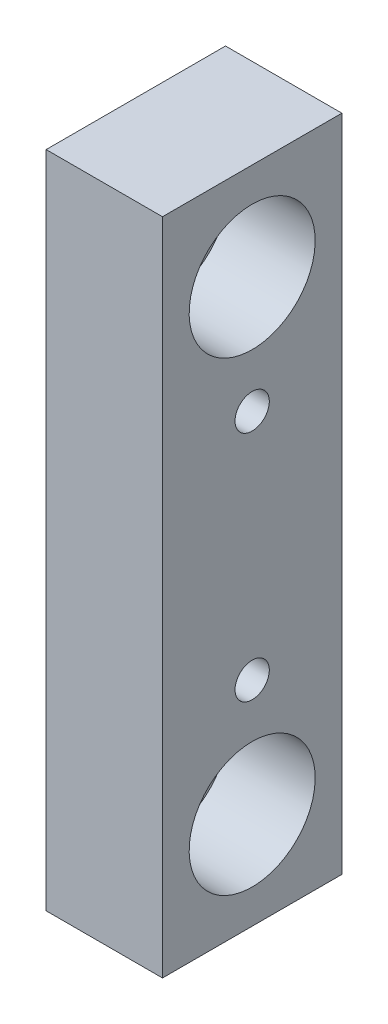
SolidWorks part; units mm, degrees
ref_plane "Front" through (0, 0, 0) normal (0, 0, 1) x (1, 0, 0)
ref_plane "Top" through (0, 0, 0) normal (0, 1, 0) x (1, 0, 0)
ref_plane "Right" through (0, 0, 0) normal (1, 0, 0) x (0, 0, -1)
sketch "Sketch1" plane through (0, 0, 0) normal (0, 0, 1) x (1, 0, 0)
  line L0 (82.55, 0) -> (0, 0) construction
  line L1 (-82.55, 101.6) -> (82.55, 101.6) construction
  line L2 (-82.55, 101.6) -> (-82.55, -101.6) construction
  line L3 (-82.55, -101.6) -> (82.55, -101.6) construction
  line L4 (82.55, 101.6) -> (82.55, -101.6) construction
  line L5 (0, 0) -> (0, 101.6) construction
  line L6 (52.3634, 101.6) -> (-52.3634, 101.6)
  line L8 (-52.3634, -101.6) -> (52.3634, -101.6)
  circle A0 centre (0, 0) radius 76.327 construction
  arc A1 (-52.3634, 101.6) -> (-52.3634, -101.6) centre (0, 0) ccw
  arc A2 (52.3634, -101.6) -> (52.3634, 101.6) centre (0, 0) ccw
  dimension "D3" = 152.654
  dimension "D4" = 228.6
  dimension "D1" = 203.2
  dimension "D2" = 165.1
extrude "Boss-Extrude1" add sketch "Sketch1" along normal mid plane 31.75
sketch "Sketch3" plane through (0, 0, 15.875) normal (0, 0, 1) x (1, 0, 0)
  circle A0 centre (0, 0) radius 74.2188
  circle A1 centre (0, 0) radius 76.327 construction
  dimension "D1" = 2.1082
extrude "Cut-Extrude2" cut sketch "Sketch3" against normal through all
sketch "Sketch4" plane through (0, 0, 0) normal (0, 1, 0) x (1, 0, 0)
  line L0 (52.3634, -15.875) -> (114.3, -15.875) construction
  line L1 (76.2508, -28.575) -> (76.2508, -25.0038)
  line L2 (76.2508, -25.0038) -> (74.2188, -25.0038)
  line L3 (0, 0) -> (30.5583, 0) construction
  line L4 (50.8, 15.875) -> (50.8, 19.3424)
  line L5 (50.8, 19.3424) -> (60.325, 22.8092)
  line L6 (0, 0) -> (0, 54.6666) construction
  line L7 (60.325, 22.8092) -> (60.325, 28.575)
  line L8 (60.325, 28.575) -> (47.6758, 28.575)
  line L9 (45.6438, 25.0038) -> (45.6438, 15.875)
  line L10 (45.6438, 15.875) -> (50.8, 15.875)
  line L11 (47.6758, 25.0038) -> (45.6438, 25.0038)
  line L12 (47.6758, 28.575) -> (47.6758, 25.0038)
  line L13 (114.3, 15.875) -> (52.3634, 15.875) construction
  line L20 (74.2188, -15.875) -> (79.375, -15.875)
  line L21 (74.2188, -25.0038) -> (74.2188, -15.875)
  line L22 (88.9, -28.575) -> (76.2508, -28.575)
  line L23 (88.9, -22.8092) -> (88.9, -28.575)
  line L24 (79.375, -19.3424) -> (88.9, -22.8092)
  line L25 (79.375, -15.875) -> (79.375, -19.3424)
  dimension "D1" = 5.1562
  dimension "D2" = 5.7658
  dimension "D3" = 177.8
  dimension "D4" = 9.2326
  dimension "D5" = 12.7
  dimension "D6" = 14.6812
  dimension "D7" = 20
  dimension "D8" = 2.032
  dimension "D9" = 3.5712
  dimension "D10" = 5.1562
  dimension "D11" = 12.7
  dimension "D12" = 5.7658
  dimension "D13" = 3.5712
  dimension "D14" = 20
  dimension "D15" = 9.2326
  dimension "D16" = 2.032
  dimension "D17" = 14.6812
  dimension "D18" = 120.65
revolve "Revolve1" add sketch "Sketch4" angle 360 mid plane about L6
sketch "Sketch5" plane through (0, 0, -15.875) normal (0, 0, 1) x (1, 0, 0)
  circle A0 centre (0, 0) radius 45.6438 construction
  circle A1 centre (0, 0) radius 45.6438
  circle A2 centre (0, 0) radius 74.2188 construction
  circle A3 centre (0, 0) radius 74.2188
extrude "Boss-Extrude2" add sketch "Sketch5" along normal up to surface (40.8788 mm away)
sketch "Sketch6" plane through (0, 0, 0) normal (0, 1, 0) x (1, 0, 0)
  line L0 (32.1437, -0.635) -> (32.1437, 0.635) construction
  line L1 (-25.7937, -6.985) -> (25.7937, -6.985) construction
  line L2 (25.7937, 6.985) -> (-25.7937, 6.985) construction
  line L3 (-32.1437, 0.635) -> (-32.1437, -0.635) construction
  line L4 (32.1437, -0.635) -> (32.1437, 0.635)
  line L5 (-25.7937, -6.985) -> (25.7937, -6.985)
  line L6 (25.7937, 6.985) -> (-25.7937, 6.985)
  line L7 (-32.1437, 0.635) -> (-32.1437, -0.635)
  arc A0 (25.7937, -6.985) -> (32.1437, -0.635) centre (25.7937, -0.635) ccw construction
  arc A1 (32.1437, 0.635) -> (25.7937, 6.985) centre (25.7937, 0.635) ccw construction
  arc A2 (-25.7937, 6.985) -> (-32.1437, 0.635) centre (-25.7937, 0.635) ccw construction
  arc A3 (-32.1437, -0.635) -> (-25.7937, -6.985) centre (-25.7937, -0.635) ccw construction
  arc A4 (25.7937, -6.985) -> (32.1437, -0.635) centre (25.7937, -0.635) ccw
  arc A5 (32.1437, 0.635) -> (25.7937, 6.985) centre (25.7937, 0.635) ccw
  arc A6 (-25.7937, 6.985) -> (-32.1437, 0.635) centre (-25.7937, 0.635) ccw
  arc A7 (-32.1437, -0.635) -> (-25.7937, -6.985) centre (-25.7937, -0.635) ccw
extrude "Cut-Extrude3" cut sketch "Sketch6" against normal mid plane 228.6
hole_wizard "#10-32 Tapped Hole1" positions "Sketch8" profile "Sketch7" tap size "#10-32" standard "Ansi Inch"
sketch "Sketch8" plane through (0, 101.6, 0) normal (0, 1, 0) x (-1, 0, 0)
  point P0 (-41.275, 7.9375)
  point P1 (-41.275, -7.9375)
  point P4 (41.275, -7.9375)
  point P7 (41.275, 7.9375)
sketch "Sketch7" plane through (41.275, 101.6, 7.9375) normal (1, 0, 0) x (0, 0, 1)
  line L0 (0, 0) -> (0, 17.9773)
  line L1 (0, 17.9773) -> (2.0193, 16.764)
  line L2 (2.0193, 16.764) -> (2.0193, 0)
  line L5 (2.0193, 0) -> (0, 0)
  line L10 (0, 17.9773) -> (-2.0193, 16.764) construction
  line L11 (0, -6.35) -> (0, 107.95) construction
  dimension "Tap Drill Dia." = 4.0386
  dimension "Tap Drill Depth" = 16.764
  dimension "Drill Angle" = 118
hole_wizard "#10-32 Tapped Hole2" positions "Sketch10" profile "Sketch9" tap size "#10-32" standard "Ansi Inch"
sketch "Sketch10" plane through (0, -101.6, 0) normal (0, -1, 0) x (1, 0, 0)
  point P0 (41.275, -7.9375)
  point P1 (-41.275, 7.9375)
  point P4 (-41.275, -7.9375)
  point P7 (41.275, 7.9375)
sketch "Sketch9" plane through (41.275, -101.6, -7.9375) normal (1, 0, 0) x (0, 0, -1)
  line L0 (0, 0) -> (0, 17.9773)
  line L1 (0, 17.9773) -> (2.0193, 16.764)
  line L2 (2.0193, 16.764) -> (2.0193, 0)
  line L5 (2.0193, 0) -> (0, 0)
  line L10 (0, 17.9773) -> (-2.0193, 16.764) construction
  line L11 (0, -6.35) -> (0, 107.95) construction
  dimension "Tap Drill Dia." = 4.0386
  dimension "Tap Drill Depth" = 16.764
  dimension "Drill Angle" = 118
sketch "Sketch15" plane through (0, 0, 15.875) normal (0, 0, 1) x (1, 0, 0)
  line L0 (50.8, 101.6) -> (50.8, 81.3352)
  line L1 (0, 0) -> (28.4177, 0) construction
  line L2 (0, 0) -> (0, 27.3386) construction
  line L3 (50.8, -101.6) -> (-50.8, -101.6)
  line L4 (-50.8, -101.6) -> (-50.8, -81.3352)
  line L5 (-50.8, 101.6) -> (-50.8, 81.3352)
  line L6 (52.3634, 101.6) -> (-52.3634, 101.6) construction
  line L7 (-52.3634, -101.6) -> (52.3634, -101.6) construction
  line L8 (50.8, 101.6) -> (-50.8, 101.6)
  line L9 (50.8, -101.6) -> (50.8, -81.3352)
  line L11 (-101.6, 50.8) -> (-101.6, -50.8)
  line L12 (-101.6, -50.8) -> (-81.3352, -50.8)
  line L13 (-101.6, 50.8) -> (-81.3352, 50.8)
  arc A0 (-55.6846, 71.3247) -> (-71.3247, 55.6846) centre (0, 0) ccw
  arc A1 (55.6846, -71.3247) -> (55.6846, 71.3247) centre (0, 0) ccw
  arc A2 (-50.8, -81.3352) -> (-55.6846, -71.3247) centre (-63.5, -81.3352) ccw
  arc A3 (50.8, -81.3352) -> (55.6846, -71.3247) centre (63.5, -81.3352) cw
  arc A4 (55.6846, 71.3247) -> (50.8, 81.3352) centre (63.5, 81.3352) cw
  arc A5 (-50.8, 81.3352) -> (-55.6846, 71.3247) centre (-63.5, 81.3352) cw
  arc A6 (-71.3247, -55.6846) -> (-55.6846, -71.3247) centre (0, 0) ccw
  arc A7 (-81.3352, -50.8) -> (-71.3247, -55.6846) centre (-81.3352, -63.5) cw
  arc A8 (-71.3247, 55.6846) -> (-81.3352, 50.8) centre (-81.3352, 63.5) cw
  dimension "D1" = 180.975
  dimension "D2" = 12.7
  dimension "D6" = 12.7
  dimension "D3" = 50.8
  dimension "D4" = 50.8
  dimension "D5" = 101.6
  dimension "D7" = 101.6
extrude "Cut-Extrude7" cut sketch "Sketch15" against normal blind 34.925 flip side to cut
sketch "Sketch12" plane through (0, 0, -15.875) normal (0, 0, -1) x (-1, 0, 0)
  line L0 (0, 0) -> (120.65, 0) construction
  line L1 (120.65, 76.2) -> (88.9, 76.2)
  line L2 (120.65, 76.2) -> (120.65, -76.2)
  line L3 (120.65, -76.2) -> (88.9, -76.2)
  line L4 (88.9, 76.2) -> (88.9, 50.095)
  line L5 (65.6665, -6.1336) -> (88.9, -12.359)
  line L6 (101.6, 50.8) -> (101.6, -50.8) construction
  line L7 (88.9, 50.095) -> (61.8107, 3.175)
  line L8 (88.9, -12.359) -> (88.9, -76.2)
  line L9 (66.675, 0) -> (109.7618, 70.3113) construction
  line L10 (66.675, 0) -> (145.4194, -6.1973) construction
  line L11 (66.4882, -2.3739) -> (145.2326, -8.5712) construction
  line L12 (64.6447, 1.2442) -> (107.7315, 71.5555) construction
  arc A0 (65.6665, -6.1336) -> (61.8107, 3.175) centre (67.31, 0) cw
  point P10 (59.9777, 0)
  dimension "D5" = 6.35
  dimension "D2" = 60.96
  dimension "D1" = 152.4
  dimension "D3" = 60
  dimension "D4" = 120.65
  dimension "D6" = 12.7
  dimension "D7" = 58.5
  dimension "D8" = 4.5
  dimension "D11" = 15
  dimension "D9" = 2.3813
  dimension "D10" = 2.3813
extrude "ROD POCKET" cut sketch "Sketch12" against normal blind 8.7312
sketch "Sketch27" plane through (0, 0, -15.875) normal (0, 0, -1) x (-1, 0, 0)
  line L0 (60.96, 0) -> (60.96, -70.7603)
  line L1 (60.96, -70.7603) -> (88.9, -66.1783)
  line L2 (65.6665, -6.1336) -> (88.9, -12.359) construction
  line L3 (88.9, -12.359) -> (88.9, -50.8) construction
  line L4 (65.6665, -6.1336) -> (88.9, -12.359)
  line L5 (88.9, -12.359) -> (88.9, -66.1783)
  arc A0 (61.8107, 3.175) -> (65.6665, -6.1336) centre (67.31, 0) ccw construction
  arc A1 (60.96, 0) -> (65.6665, -6.1336) centre (67.31, 0) ccw
extrude "Cut-Extrude11" cut sketch "Sketch27" against normal up to surface (8.7312 mm away)
sketch "Sketch11" plane through (0, 0, 25.0038) normal (0, 0, 1) x (1, 0, 0)
  circle A1 centre (-66.675, 0) radius 2.3813
sketch "Sketch13" plane through (0, 0, 25.0038) normal (0, 0, 1) x (1, 0, 0)
  circle A0 centre (-66.675, 0) radius 2.413
  dimension "D1" = 4.826
extrude "Cut-Extrude5" cut sketch "Sketch13" against normal up to surface (40.8788 mm away)
sketch "Sketch14" plane through (0, 0, 25.0038) normal (0, 0, 1) x (1, 0, 0)
  line L1 (-66.675, 0) -> (0, 0) construction
  line L2 (-57.5754, -2.1891) -> (-68.3959, -20.9308)
  line L3 (-68.3959, 20.9308) -> (-57.5754, 2.1891)
  line L4 (-57.15, 0.6016) -> (-57.15, -0.6016)
  line L5 (-88.9, 50.095) -> (-61.8107, 3.175) construction
  arc A0 (-57.15, -0.6016) -> (-57.5754, -2.1891) centre (-60.325, -0.6016) cw
  circle A1 centre (0, 0) radius 76.2508
  arc A2 (-68.8677, -32.7327) -> (-68.8677, 32.7327) centre (0, 0) ccw
  arc A3 (-68.3959, -20.9308) -> (-68.8677, -32.7327) centre (-57.3974, -27.2808) ccw
  arc A4 (-68.3959, 20.9308) -> (-68.8677, 32.7327) centre (-57.3974, 27.2808) cw
  arc A5 (-57.5754, 2.1891) -> (-57.15, 0.6016) centre (-60.325, 0.6016) cw
  circle A6 centre (-66.675, 0) radius 8.9751 construction
  point P10 (-71.5421, -26.3802)
  point P13 (-71.5421, 26.3802)
  dimension "D2" = 3.175
  dimension "D4" = 12.7
  dimension "D3" = 3.175
  dimension "D5" = 60
  dimension "D6" = 9.525
  dimension "D1" = 0
extrude "Cut-Extrude6" cut sketch "Sketch14" against normal blind 33.3375
sketch "Sketch16" plane through (0, 0, 25.0038) normal (0, 0, 1) x (1, 0, 0)
  circle A0 centre (-66.675, 0) radius 5.207
  circle A1 centre (-66.675, 0) radius 2.413 construction
  dimension "D1" = 2.794
extrude "Cut-Extrude8" cut sketch "Sketch16" against normal blind 2.54
sketch "Sketch17" plane through (0, 0, -15.875) normal (0, 0, -1) x (-1, 0, 0)
  line L0 (101.6, 52.3875) -> (101.6, -52.3875)
  line L1 (73.7803, 52.3875) -> (101.6, 52.3875)
  line L2 (73.7803, -52.3875) -> (101.6, -52.3875)
  arc A0 (71.3247, 55.6846) -> (55.6846, 71.3247) centre (0, 0) ccw construction
  arc A1 (71.3247, 55.6846) -> (55.6846, 71.3247) centre (0, 0) ccw construction
  arc A2 (71.3247, 55.6846) -> (55.6846, 71.3247) centre (0, 0) ccw construction
  arc A3 (73.7803, -52.3875) -> (73.7803, 52.3875) centre (0, 0) ccw
  dimension "D1" = 101.6
  dimension "D2" = 104.775
  dimension "D3" = 52.3875
extrude "Boss-Extrude3" [suppressed] add sketch "Sketch17" against normal up to vertex
chamfer "Chamfer1" distance 3.175 angle 45 1 edges at (-64.262, 0, -7.1438)
sketch "Sketch19" plane through (0, 0, -7.1438) normal (0, 0, -1) x (-1, 0, 0)
  line L0 (66.675, 0) -> (146.05, 0) construction
  line L4 (66.675, 0) -> (142.1651, 24.5282) construction
  line L5 (66.675, 0) -> (130.8907, 46.6555) construction
  line L6 (66.675, 0) -> (113.3305, 64.2157) construction
  line L7 (66.675, 0) -> (145.8053, -6.2277) construction
  line L9 (108.1483, 67.6783) -> (66.675, 0) construction
  circle A0 centre (66.675, 0) radius 2.413 construction
  arc A1 (145.8053, -6.2277) -> (108.1483, 67.6783) centre (66.675, 0) ccw construction
  dimension "D3" = 158.75
  dimension "D2" = 18
  dimension "D4" = 4.5
  dimension "D5" = 4.5
  dimension "D1" = 4
sketch "Sketch22" plane through (0, 0, -8.3337) normal (0, 0, 1) x (1, 0, 0)
  line L0 (50.5276, -41.5474) -> (54.4255, -45.4453)
  line L1 (50.5276, -41.5474) -> (41.5474, -50.5276) construction
  line L2 (45.4453, -54.4255) -> (41.5474, -50.5276)
  line L3 (46.0375, -46.0375) -> (-46.0375, 46.0375) construction
  line L4 (46.0375, 46.0375) -> (-46.0375, -46.0375) construction
  line L5 (0, 0) -> (0, -35.1849) construction
  line L6 (0, 0) -> (-30.9427, 0) construction
  line L7 (-45.4453, -54.4255) -> (-41.5474, -50.5276)
  line L10 (-50.5276, -41.5474) -> (-54.4255, -45.4453)
  line L11 (-50.5276, 41.5474) -> (-54.4255, 45.4453)
  line L12 (-45.4453, 54.4255) -> (-41.5474, 50.5276)
  line L13 (50.5276, 41.5474) -> (54.4255, 45.4453)
  line L14 (45.4453, 54.4255) -> (41.5474, 50.5276)
  arc A0 (-60.96, -45.8046) -> (-68.8677, 32.7327) centre (0, 0) ccw construction
  arc A1 (50.5276, -41.5474) -> (41.5474, -50.5276) centre (46.0375, -46.0375) ccw
  arc A2 (-44.8809, -61.6433) -> (-45.4453, -54.4255) centre (-42.0777, -57.7931) cw
  arc A5 (-50.5276, -41.5474) -> (-41.5474, -50.5276) centre (-46.0375, -46.0375) cw
  arc A6 (61.6433, -44.8809) -> (54.4255, -45.4453) centre (57.7931, -42.0777) cw
  arc A7 (44.8809, -61.6433) -> (45.4453, -54.4255) centre (42.0777, -57.7931) ccw
  arc A8 (-61.6433, -44.8809) -> (-54.4255, -45.4453) centre (-57.7931, -42.0777) ccw
  arc A9 (-44.8809, -61.6433) -> (-61.6433, -44.8809) centre (0, 0) cw
  arc A10 (-61.6433, 44.8809) -> (-54.4255, 45.4453) centre (-57.7931, 42.0777) cw
  arc A15 (-44.8809, 61.6433) -> (-61.6433, 44.8809) centre (0, 0) ccw
  arc A16 (44.8809, -61.6433) -> (61.6433, -44.8809) centre (0, 0) ccw
  arc A17 (-44.8809, 61.6433) -> (-45.4453, 54.4255) centre (-42.0777, 57.7931) ccw
  arc A18 (-50.5276, 41.5474) -> (-41.5474, 50.5276) centre (-46.0375, 46.0375) ccw
  arc A19 (61.6433, 44.8809) -> (54.4255, 45.4453) centre (57.7931, 42.0777) ccw
  arc A20 (44.8809, 61.6433) -> (61.6433, 44.8809) centre (0, 0) cw
  arc A21 (44.8809, 61.6433) -> (45.4453, 54.4255) centre (42.0777, 57.7931) cw
  arc A22 (50.5276, 41.5474) -> (41.5474, 50.5276) centre (46.0375, 46.0375) cw
  dimension "D1" = 12.7
  dimension "D4" = 4.7625
  dimension "D5" = 90
  dimension "D2" = 45
  dimension "D3" = 90
  dimension "D6" = 46.0375
  dimension "D7" = 46.0375
extrude "Boss-Extrude4" add sketch "Sketch22" along normal blind 12.7
hole_wizard "#10-32 Tapped Hole3" positions "Sketch21" profile "Sketch20" tap size "#10-32" standard "Ansi Inch"
sketch "Sketch21" plane through (42.0212, -48.2701, 4.3663) normal (0, 0, 1) x (1, 0, 0)
  point P1 (4.0163, 94.3076)
  point P4 (4.0163, 2.2326)
  point P7 (-88.0587, 2.2326)
  point P10 (-88.0587, 94.3076)
sketch "Sketch20" plane through (46.0375, 46.0375, 4.3663) normal (1, 0, 0) x (0, -1, 0)
  line L0 (0, 0) -> (0, 12.7)
  line L1 (0, 12.7) -> (2.0193, 12.7)
  line L2 (2.0193, 12.7) -> (2.0193, 0)
  line L5 (2.0193, 0) -> (0, 0)
  line L10 (0, 12.7) -> (-2.0193, 12.7) construction
  line L11 (0, -6.35) -> (0, 107.95) construction
  dimension "Tap Drill Dia." = 4.0386
  dimension "Tap Drill Depth" = 12.7
  dimension "Drill Angle" = 180
sketch "Sketch23" plane through (-101.6, 0, 0) normal (-1, 0, 0) x (0, 0, 1)
  line L0 (4.3656, -50.8) -> (4.3656, 50.8) construction
  line L1 (-7.1438, -50.8) -> (15.875, -50.8) construction
  line L2 (-7.1438, 50.8) -> (15.875, 50.8) construction
  circle A0 centre (4.3656, -38.1) radius 5.1562
  circle A1 centre (4.3656, 38.1) radius 5.1562
  dimension "D1" = 10.3124
  dimension "D2" = 38.1
  dimension "D3" = 38.1
extrude "SHV THRU HOLE" cut sketch "Sketch23" against normal blind 41.275
ref_plane "Plane1" through (-88.9, 0, 0) normal (-1, 0, 0) x (0, 0, 1)
hole_wizard "#4-40 Tapped Hole1" positions "Sketch26" profile "Sketch25" tap size "#4-40" standard "Ansi Inch"
sketch "Sketch26" plane through (0, 0, 25.0038) normal (0, 0, 1) x (1, 0, 0)
  point P0 (-71.4388, -4.7638)
  point P1 (-71.4388, 4.7638)
  point P4 (-61.9112, 4.7638)
  point P7 (-61.9112, -4.7638)
sketch "Sketch25" plane through (-71.4388, -4.7638, 25.0038) normal (1, 0, 0) x (0, -1, 0)
  line L0 (0, 0) -> (0, 12.1092)
  line L1 (0, 12.1092) -> (1.1303, 11.43)
  line L2 (1.1303, 11.43) -> (1.1303, 0)
  line L5 (1.1303, 0) -> (0, 0)
  line L10 (0, 12.1092) -> (-1.1303, 11.43) construction
  line L11 (0, -6.35) -> (0, 107.95) construction
  dimension "Tap Drill Dia." = 2.2606
  dimension "Tap Drill Depth" = 11.43
  dimension "Drill Angle" = 118
sketch "Sketch28" plane through (0, 0, -7.1438) normal (0, 0, 1) x (1, 0, 0)
  line L1 (-57.5754, -2.1891) -> (-68.3959, -20.9308) construction
  line L2 (-57.15, -0.6016) -> (-57.15, -36.918)
  line L4 (-57.5754, -2.1891) -> (-68.3959, -20.9308)
  line L12 (-50.5276, -41.5474) -> (-54.4255, -45.4453) construction
  line L13 (-50.5276, -41.5474) -> (-54.4255, -45.4453)
  arc A0 (-68.3959, -20.9308) -> (-68.8677, -32.7327) centre (-57.3974, -27.2808) ccw construction
  arc A1 (-57.5754, -2.1891) -> (-57.15, -0.6016) centre (-60.325, -0.6016) ccw construction
  arc A2 (-68.3959, -20.9308) -> (-68.8677, -32.7327) centre (-57.3974, -27.2808) ccw
  circle A3 centre (0, 0) radius 76.2508 construction
  arc A6 (-57.5754, -2.1891) -> (-57.15, -0.6016) centre (-60.325, -0.6016) ccw
  arc A8 (-61.6433, -44.8809) -> (-54.4255, -45.4453) centre (-57.7931, -42.0777) ccw construction
  arc A9 (-68.8677, -32.7327) -> (-61.6433, -44.8809) centre (0, 0) ccw
  arc A10 (-61.6433, -44.8809) -> (-54.4255, -45.4453) centre (-57.7931, -42.0777) ccw
  arc A11 (-57.15, -36.918) -> (-49.6661, -40.8264) centre (-52.3875, -36.918) ccw
  arc A12 (-41.5474, -50.5276) -> (-50.5276, -41.5474) centre (-46.0375, -46.0375) ccw construction
  arc A13 (-49.6661, -40.8264) -> (-50.5276, -41.5474) centre (-46.0375, -46.0375) ccw
  dimension "D1" = 9.525
extrude "Boss-Extrude5" add sketch "Sketch28" along normal blind 5.1587
sketch "Sketch24" plane through (-88.9, 0, 0) normal (1, 0, 0) x (0, 0, -1)
  circle A2 centre (-4.3656, -38.1) radius 11.1125
  circle A3 centre (-4.3656, 38.1) radius 11.1125
  circle A4 centre (-4.3656, -38.1) radius 5.1562 construction
  circle A5 centre (-4.3656, 38.1) radius 5.1562 construction
  dimension "D1" = 22.225
extrude "C'BORE" cut sketch "Sketch24" along normal blind 30.1625
sketch "Sketch30" plane through (0, 0, -8.3337) normal (0, 0, 1) x (1, 0, 0)
  circle A0 centre (0, 0) radius 49.403
  circle A1 centre (0, 0) radius 45.6438 construction
  circle A2 centre (0, 0) radius 45.6438
  dimension "D1" = 98.806
extrude "Boss-Extrude7" add sketch "Sketch30" along normal blind 4.7752
chamfer "Chamfer2" distance 0.762 angle 45 1 edges at (49.403, 0, -3.5585)
sketch "Sketch32" plane through (0, 0, -7.1438) normal (0, 0, -1) x (-1, 0, 0)
  line L0 (60.96, -45.6347) -> (60.96, -8.0515)
  line L10 (60.96, -45.8046) -> (60.96, -66.872)
  line L11 (81.3352, -50.8) -> (101.6, -50.8)
  line L12 (101.6, -50.8) -> (101.6, 50.8)
  line L13 (101.6, 50.8) -> (88.9, 50.8)
  line L14 (88.9, 50.8) -> (88.9, 50.095)
  line L15 (88.9, 50.095) -> (61.8107, 3.175)
  line L16 (60.96, 0) -> (60.96, -8.0515)
  line L17 (60.96, -8.0515) -> (57.5754, -2.1891)
  line L18 (57.15, -0.6016) -> (57.15, -36.918)
  line L19 (50.5276, -41.5474) -> (54.4255, -45.4453)
  line L27 (60.96, -8.0515) -> (57.5754, -2.1891)
  line L28 (57.15, -0.6016) -> (57.15, -36.918)
  line L29 (50.5276, -41.5474) -> (54.4255, -45.4453)
  arc A8 (54.4255, -45.4453) -> (61.6433, -44.8809) centre (57.7931, -42.0777) ccw
  arc A9 (60.96, -45.8046) -> (61.6433, -44.8809) centre (0, 0) ccw
  arc A10 (60.96, -66.872) -> (71.3247, -55.6846) centre (0, 0) ccw
  arc A11 (81.3352, -50.8) -> (71.3247, -55.6846) centre (81.3352, -63.5) ccw
  arc A12 (61.8107, 3.175) -> (60.96, 0) centre (67.31, 0) ccw
  arc A13 (57.15, -0.6016) -> (57.5754, -2.1891) centre (60.325, -0.6016) ccw
  arc A14 (49.6661, -40.8264) -> (57.15, -36.918) centre (52.3875, -36.918) ccw
  arc A15 (50.5276, -41.5474) -> (49.6661, -40.8264) centre (46.0375, -46.0375) ccw
  arc A16 (54.4255, -45.4453) -> (60.96, -45.6347) centre (57.7931, -42.0777) ccw
  arc A21 (57.15, -0.6016) -> (57.5754, -2.1891) centre (60.325, -0.6016) ccw
  arc A22 (49.6661, -40.8264) -> (57.15, -36.918) centre (52.3875, -36.918) ccw
  arc A23 (50.5276, -41.5474) -> (49.6661, -40.8264) centre (46.0375, -46.0375) ccw
  dimension "D1" = 0
extrude "Boss-Extrude8" add sketch "Sketch32" along normal up to vertex
sketch "Sketch33" plane through (0, 0, -7.1438) normal (0, 0, -1) x (-1, 0, 0)
  line L0 (60.96, 0) -> (60.96, -66.872) construction
  line L1 (60.96, -46.5648) -> (62.1591, -46.5648)
  line L2 (60.96, -46.5648) -> (60.96, -43.9294)
  line L3 (60.96, -43.9294) -> (62.1591, -43.9294)
  line L4 (62.1591, -46.5648) -> (62.1591, -43.9294)
extrude "Cut-Extrude12" cut sketch "Sketch33" along normal up to vertex
sketch "Sketch34" plane through (0, 0, -7.1438) normal (0, 0, -1) x (-1, 0, 0)
  line L0 (88.9, 70.8258) -> (88.9, -73.9207)
  line L1 (88.9, 50.8) -> (88.9, 50.095) construction
extrude "Cut-Extrude13" cut sketch "Sketch34" against normal through all and the other way through all flip side to cut
sketch "Sketch43" plane through (-88.9, 0, 0) normal (1, 0, 0) x (0, 0, -1)
  line L0 (-15.8718, 26.5938) -> (7.1406, 26.5938)
  line L1 (-15.8718, 50.8) -> (-15.8718, 26.5938)
  line L2 (-15.8718, 26.5938) -> (-15.8718, 50.8)
  line L3 (-15.8718, 50.8) -> (7.1406, 50.8)
  line L4 (7.1406, 50.8) -> (7.1406, 26.5938)
  line L5 (7.1406, 26.5938) -> (7.1406, 50.8)
  line L6 (-4.3656, 38.1) -> (-4.3656, 50.8) construction
  line L7 (-15.8718, -50.8) -> (7.1406, -50.8)
  line L8 (0, 0) -> (16.8062, 0) construction
  line L9 (7.1406, -50.8) -> (7.1406, -26.5938)
  line L10 (-15.8718, -26.5938) -> (7.1406, -26.5938)
  line L11 (-15.8718, -50.8) -> (-15.8718, -26.5938)
  line L12 (7.1438, 50.8) -> (-15.875, 50.8) construction
  circle A0 centre (-4.3656, 38.1) radius 5.1562 construction
  circle A1 centre (-4.3656, 38.1) radius 5.1562
  circle A2 centre (-4.3656, -38.1) radius 5.1562
  dimension "D1" = 23.0124
  dimension "D3" = 11.5062
extrude "Boss-Extrude9" [suppressed] add sketch "Sketch43" against normal up to vertex
sketch "Sketch44" plane through (-88.9, 0, 0) normal (1, 0, 0) x (0, 0, -1)
  circle A0 centre (-4.3656, 38.1) radius 10.3187
  circle A1 centre (-4.3656, -38.1) radius 10.3187
  dimension "D1" = 20.6375
extrude "SHV C'BORE" cut sketch "Sketch44" against normal blind 7.9375
chamfer "Chamfer3" [suppressed] distance 6.35 angle 45
sketch "Sketch46" plane through (-88.9, 0, 0) normal (1, 0, 0) x (0, 0, -1)
  line L4 (-15.875, -50.8) -> (7.1438, -50.8)
  line L5 (7.1438, -50.8) -> (7.1438, 50.8)
  line L6 (7.1438, 50.8) -> (-15.875, 50.8)
  line L7 (-15.875, 50.8) -> (-15.875, -50.8)
  line L8 (-15.875, -50.8) -> (7.1438, -50.8)
  line L9 (7.1438, -50.8) -> (7.1438, 50.8)
  line L10 (7.1438, 50.8) -> (-15.875, 50.8)
  line L11 (-15.875, 50.8) -> (-15.875, -50.8)
  circle A0 centre (-4.3656, 38.1) radius 10.3188 construction
  circle A1 centre (-4.3656, -38.1) radius 10.3187 construction
  circle A2 centre (-4.3656, 38.1) radius 10.3188
  circle A3 centre (-4.3656, -38.1) radius 10.3187
  dimension "D1" = 0
extrude "Boss-Extrude10" add sketch "Sketch46" along normal blind 6.35
sketch "Sketch47" plane through (0, 0, -7.1438) normal (0, 0, -1) x (-1, 0, 0)
  line L4 (101.6, 50.8) -> (82.55, 50.8)
  line L5 (82.55, 50.8) -> (82.55, -50.8)
  line L6 (82.55, -50.8) -> (101.6, -50.8)
  line L7 (101.6, -50.8) -> (101.6, 50.8)
  line L8 (101.6, 50.8) -> (82.55, 50.8)
  line L9 (82.55, 50.8) -> (82.55, -50.8)
  line L10 (82.55, -50.8) -> (101.6, -50.8)
  line L11 (101.6, -50.8) -> (101.6, 50.8)
  dimension "D1" = 0
extrude "Boss-Extrude11" add sketch "Sketch47" along normal blind 3.175
sketch "Sketch48" plane through (0, 0, 15.875) normal (0, 0, 1) x (1, 0, 0)
  line L4 (-101.6, -50.8) -> (-82.55, -50.8)
  line L5 (-82.55, -50.8) -> (-82.55, 50.8)
  line L6 (-82.55, 50.8) -> (-101.6, 50.8)
  line L7 (-101.6, 50.8) -> (-101.6, -50.8)
  line L8 (-101.6, -50.8) -> (-82.55, -50.8)
  line L9 (-82.55, -50.8) -> (-82.55, 50.8)
  line L10 (-82.55, 50.8) -> (-101.6, 50.8)
  line L11 (-101.6, 50.8) -> (-101.6, -50.8)
  dimension "D1" = 0
extrude "Boss-Extrude12" add sketch "Sketch48" along normal blind 3.175
sketch "Sketch49" plane through (0, 50.8, 0) normal (0, 1, 0) x (1, 0, 0)
  line L4 (-101.6, 10.3188) -> (-101.6, -19.05)
  line L5 (-101.6, -19.05) -> (-82.55, -19.05)
  line L6 (-82.55, -19.05) -> (-82.55, 10.3188)
  line L7 (-82.55, 10.3188) -> (-101.6, 10.3188)
  line L8 (-101.6, 10.3188) -> (-101.6, -19.05)
  line L9 (-101.6, -19.05) -> (-82.55, -19.05)
  line L10 (-82.55, -19.05) -> (-82.55, 10.3188)
  line L11 (-82.55, 10.3188) -> (-101.6, 10.3188)
  dimension "D1" = 0
extrude "Boss-Extrude13" add sketch "Sketch49" along normal blind 3.175
sketch "Sketch50" plane through (0, -50.8, 0) normal (0, -1, 0) x (1, 0, 0)
  line L4 (-101.6, 19.05) -> (-101.6, -10.3188)
  line L5 (-101.6, -10.3188) -> (-82.55, -10.3188)
  line L6 (-82.55, -10.3188) -> (-82.55, 19.05)
  line L7 (-82.55, 19.05) -> (-101.6, 19.05)
  line L8 (-101.6, 19.05) -> (-101.6, -10.3188)
  line L9 (-101.6, -10.3188) -> (-82.55, -10.3188)
  line L10 (-82.55, -10.3188) -> (-82.55, 19.05)
  line L11 (-82.55, 19.05) -> (-101.6, 19.05)
  dimension "D1" = 0
extrude "Boss-Extrude14" add sketch "Sketch50" along normal blind 3.175
hole_wizard "CBORE for #10 Socket Head Cap Screw1" positions "Sketch54" profile "Sketch53" counterbore size "#10" standard "Ansi Inch"
sketch "Sketch54" plane through (-101.6, 0, 0) normal (-1, 0, 0) x (0, 0, 1)
  line L0 (4.3656, 53.975) -> (4.3656, -53.975) construction
  line L1 (-10.3188, 53.975) -> (19.05, 53.975) construction
  line L2 (19.05, -53.975) -> (-10.3188, -53.975) construction
  point P1 (4.3656, 19.05)
  point P3 (4.3656, -19.05)
  dimension "D1" = 34.925
  dimension "D2" = 34.925
sketch "Sketch53" plane through (-101.6, 19.05, 4.3656) normal (0, 1, 0) x (0, 0, 1)
  line L0 (0, 0) -> (0, 19.05)
  line L1 (0, 19.05) -> (2.8067, 19.05)
  line L3 (2.8067, 19.05) -> (2.8067, 12.7)
  line L4 (2.8067, 12.7) -> (4.7625, 12.7)
  line L5 (4.7625, 12.7) -> (4.7625, 0)
  line L7 (4.7625, 0) -> (0, 0)
  line L11 (0, -6.35) -> (0, 107.95) construction
  dimension "Thru Hole Dia." = 5.6134
  dimension "Thru Hole Depth" = 19.05
  dimension "C'Bore Dia." = 9.525
  dimension "C'Bore Depth" = 12.7
equation "\"D3@Sketch43\" = \"D1@Sketch43\"/2"
